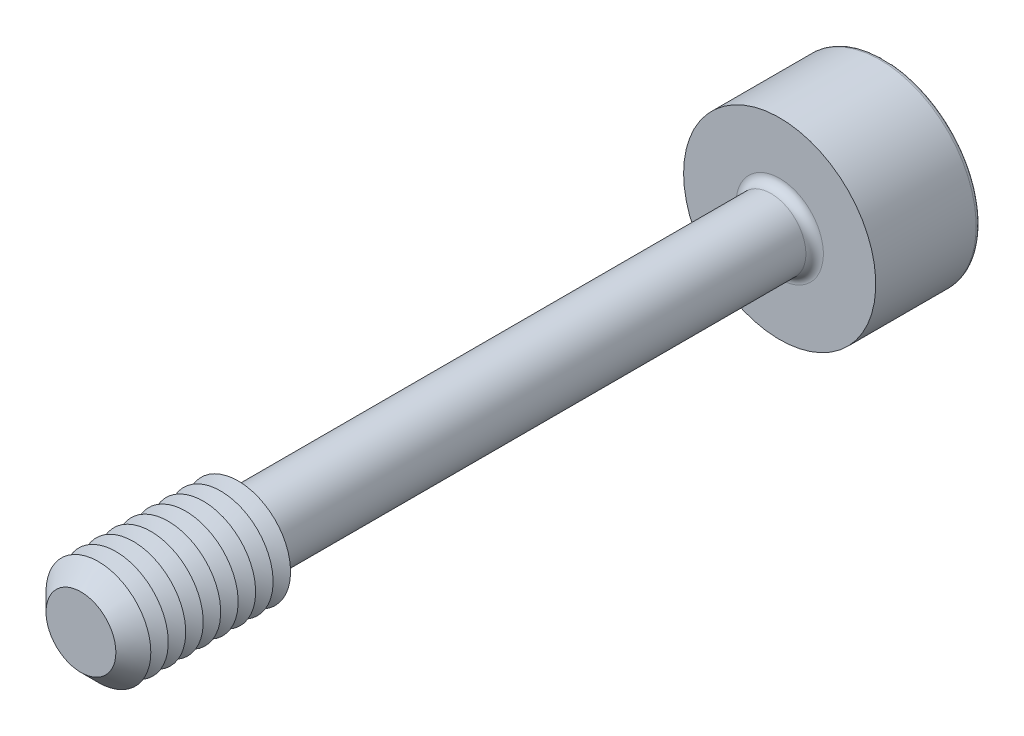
SolidWorks part; units mm, degrees
ref_plane "Front Plane" through (0, 0, 0) normal (0, 0, 1) x (1, 0, 0)
ref_plane "Top Plane" through (0, 0, 0) normal (0, 1, 0) x (1, 0, 0)
ref_plane "Right Plane" through (0, 0, 0) normal (1, 0, 0) x (0, 0, -1)
sketch "Sketch1" plane through (0, 0, 0) normal (0, 0, 1) x (1, 0, 0)
  circle A0 centre (0, 0) radius 1
  dimension "D1" = 2
extrude "Extrude1" add sketch "Sketch1" along normal mid plane 20
sketch "Sketch2" plane through (0, 0, 0) normal (1, 0, 0) x (0, 0, -1)
  line L0 (-10, 0) -> (-10, 1.5)
  line L1 (-10, 1) -> (-10, -1) construction
  line L2 (-10, 1.5) -> (-5.5, 1.5)
  line L3 (-5.5, 1.5) -> (-5.2113, 1)
  line L4 (10, 1) -> (-10, 1) construction
  line L5 (-5.2113, 1) -> (-5.2113, 0)
  line L6 (-5.2113, 0) -> (-10, 0)
  dimension "D1" = 1.5
  dimension "D2" = 120
  dimension "D3" = 4.5
revolve "Revolve1" add sketch "Sketch2" angle 360 about L6
chamfer "Chamfer1" distance 0.5 angle 45 1 edges at (0, 1.5, 10)
sketch "Sketch3" plane through (0, 0, -10) normal (0, 0, -1) x (-1, 0, 0)
  circle A0 centre (0, 0) radius 2.75
  dimension "D1" = 5.5
extrude "Extrude2" add sketch "Sketch3" along normal blind 3
sketch "Sketch4" plane through (-13.7, 0, -13) normal (0, 0, 1) x (1, 0, 0)
  line L2 (12.9783, -1.25) -> (14.4217, -1.25)
  line L3 (14.4217, -1.25) -> (15.1434, 0)
  line L4 (15.1434, 0) -> (14.4217, 1.25)
  line L6 (14.4217, 1.25) -> (12.9783, 1.25)
  line L7 (12.9783, 1.25) -> (12.2566, 0)
  line L8 (12.2566, 0) -> (12.9783, -1.25)
  circle A0 centre (13.7, 0) radius 1.25 construction
  dimension "D1" = 2.5
extrude "Extrude3" cut sketch "Sketch4" along normal blind 2.5
fillet "Fillet1" radius 0.25 1 edges at (-1, 0, -10)
fillet "Fillet2" radius 0.125 1 edges at (-2.75, 0, -13)
sketch "Sketch5" plane through (0, 0, 0) normal (1, 0, 0) x (0, 0, -1)
  line L0 (10.5, 0) -> (10.5, -1.25)
  line L1 (10.5, -1.25) -> (9.7783, 0)
  line L2 (9.7783, 0) -> (10.5, 0)
  dimension "D1" = 30
revolve "Cut-Revolve1" cut sketch "Sketch5" angle 360 about L2
sketch "Sketch6" plane through (0, 0, 0) normal (1, 0, 0) x (0, 0, -1)
  line L0 (1.332, 0) -> (-13.289, 0) construction
sketch "Sketch7" plane through (0, 0, 0) normal (1, 0, 0) x (0, 0, -1)
  line L0 (-5.5, 1.5) -> (-5.75, 1.067)
  line L1 (-5.75, 1.067) -> (-6, 1.5)
  line L2 (-5.5, 1.5) -> (-9.5, 1.5) construction
  line L3 (-6, 1.5) -> (-5.5, 1.5)
  dimension "D1" = 0.5
revolve "Cut-Revolve2" cut sketch "Sketch7" angle 360 about L0
pattern_linear "LPattern1" count 8 spacing 0.5 along (0, 0, 1) of "Cut-Revolve2"
